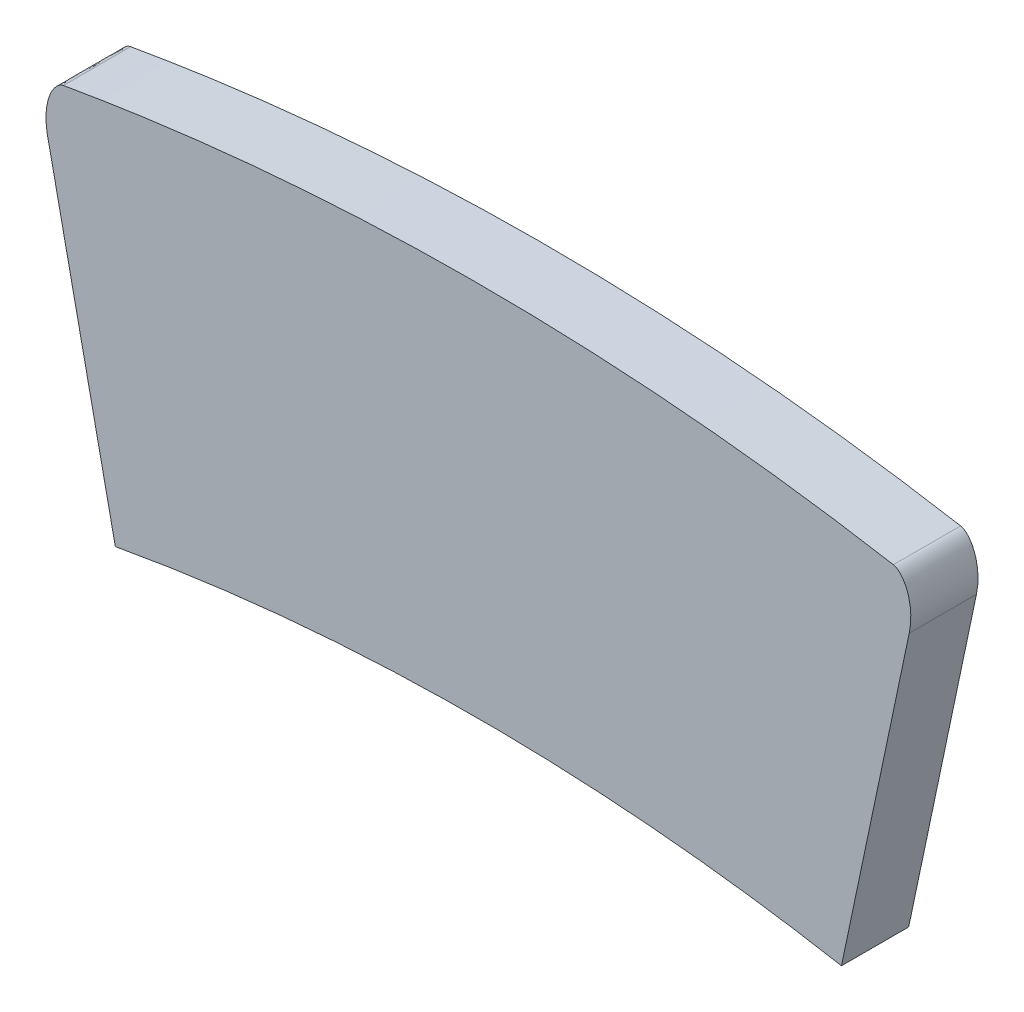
SolidWorks part; units mm, degrees
ref_plane "Plan de face" through (0, 0, 0) normal (0, 0, 1) x (1, 0, 0)
ref_plane "Plan de dessus" through (0, 0, 0) normal (0, 1, 0) x (1, 0, 0)
ref_plane "Plan de droite" through (0, 0, 0) normal (1, 0, 0) x (0, 0, -1)
sketch "Esquisse1" plane through (0, 0, 0) normal (0, 0, 1) x (1, 0, 0)
  line L0 (0.8066, 3.832) -> (0, 0)
  line L1 (-8.6425, 0) -> (-9.4491, 3.832)
  point P0 (0.6181, 4.4438)
  point P5 (-9.2606, 4.4438)
extrude "Extrusion1" add sketch "Esquisse1" along normal blind 0.8
